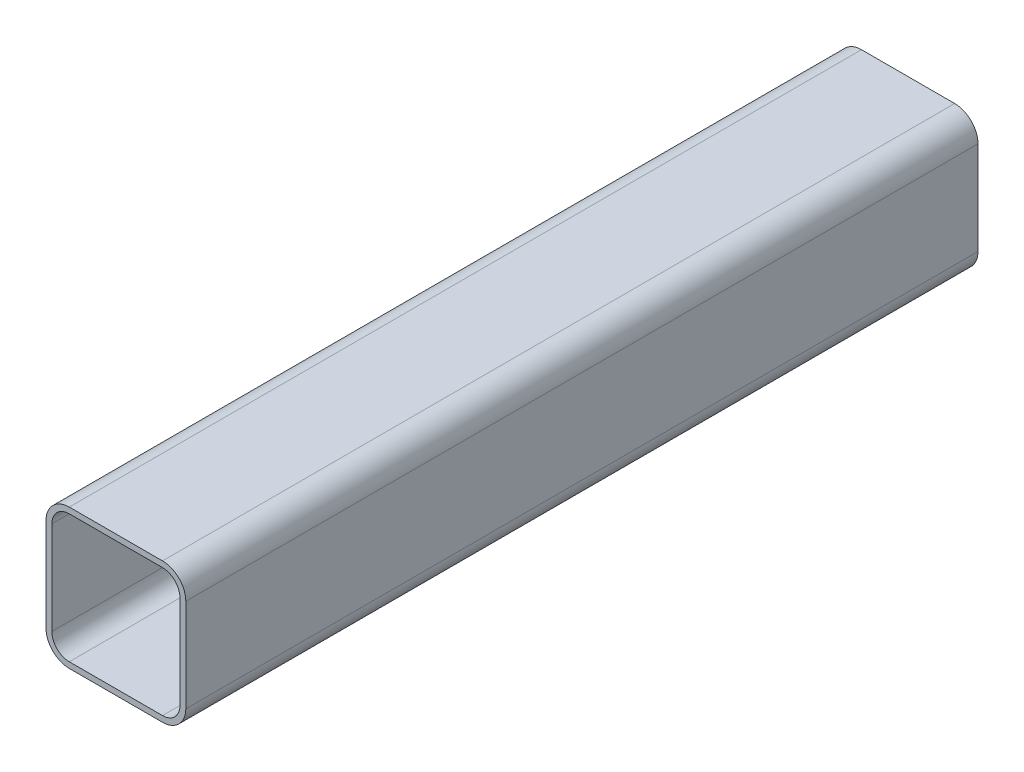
SolidWorks part; units mm, degrees
ref_plane "Front" through (0, 0, 0) normal (0, 0, 1) x (1, 0, 0)
ref_plane "Top" through (0, 0, 0) normal (0, 1, 0) x (1, 0, 0)
ref_plane "Right" through (0, 0, 0) normal (1, 0, 0) x (0, 0, -1)
sketch "Sketch1" plane through (0, 0, 0) normal (0, 0, 1) x (1, 0, 0)
  line L0 (-25.4, 38.1) -> (25.4, 38.1)
  line L1 (-38.1, 25.4) -> (-38.1, -25.4)
  line L2 (25.4, -38.1) -> (-25.4, -38.1)
  line L3 (38.1, -25.4) -> (38.1, 25.4)
  line L4 (0, 38.1) -> (0, -38.1) construction
  arc A0 (38.1, 25.4) -> (25.4, 38.1) centre (25.4, 25.4) ccw
  arc A1 (38.1, -25.4) -> (25.4, -38.1) centre (25.4, -25.4) cw
  arc A2 (-25.4, -38.1) -> (-38.1, -25.4) centre (-25.4, -25.4) cw
  arc A3 (-38.1, 25.4) -> (-25.4, 38.1) centre (-25.4, 25.4) cw
  dimension "D1" = 12.7
  dimension "D2" = 76.2
  dimension "D3" = 76.2
extrude "Base-Extrude-Thin" add sketch "Sketch1" along normal blind 431.8 thin
